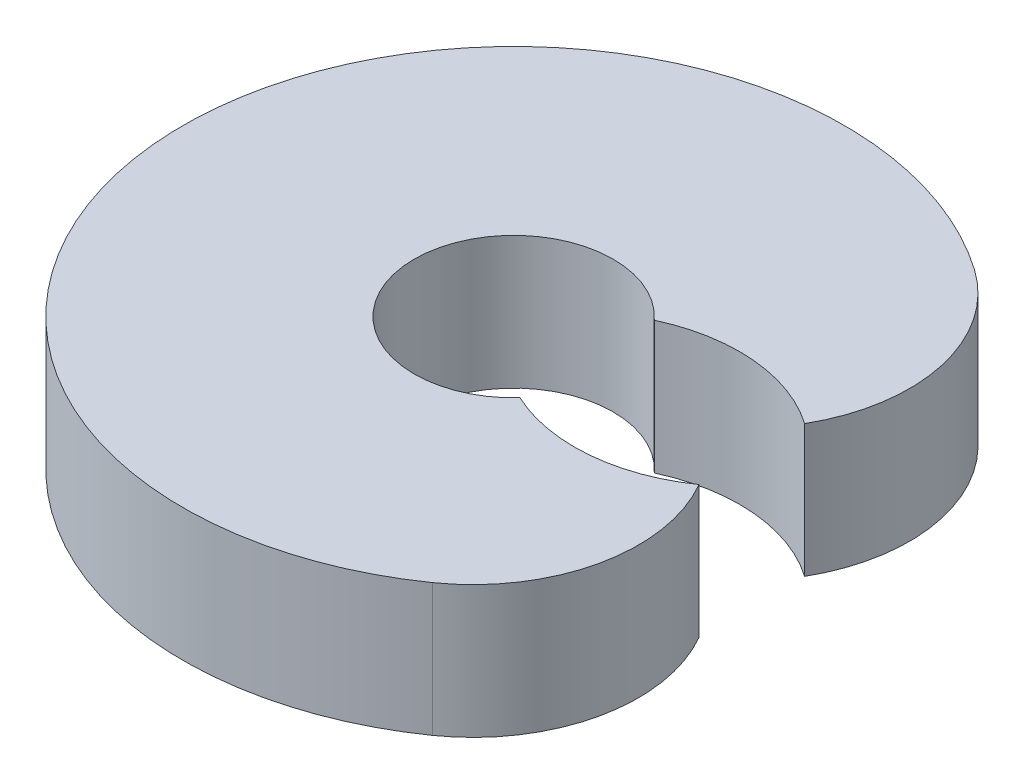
SolidWorks part; units mm, degrees
ref_plane "Front Plane" through (0, 0, 0) normal (0, 0, 1) x (1, 0, 0)
ref_plane "Top Plane" through (0, 0, 0) normal (0, 1, 0) x (1, 0, 0)
ref_plane "Right Plane" through (0, 0, 0) normal (1, 0, 0) x (0, 0, -1)
sketch "Sketch1" plane through (0, 0, 0) normal (0, 1, 0) x (1, 0, 0)
  line L0 (0, 0) -> (306.415, 437.6059) construction
  line L1 (0, 0) -> (309.4275, -441.9083) construction
  line L2 (0, 0) -> (-523.9824, 0) construction
  line L3 (143.3941, 204.788) -> (531.3216, -19.1821) construction
  line L4 (143.3941, -204.788) -> (502.0877, 2.3039) construction
  line L7 (0, 0) -> (-139.248, 298.6184) construction
  line L8 (-105.6546, 226.5769) -> (110.9872, 101.4988) construction
  arc A0 (286.7882, 409.576) -> (286.7882, -409.576) centre (0, 0) ccw
  arc A1 (110.9872, 101.4988) -> (110.9872, -101.4988) centre (0, 0) ccw
  circle A2 centre (0, 0) radius 250 construction
  arc A3 (359.9005, 79.788) -> (286.7882, 409.576) centre (143.3941, 204.788) ccw
  arc A4 (286.7882, -409.576) -> (359.9005, -79.788) centre (143.3941, -204.788) ccw
  arc A5 (110.9872, 101.4988) -> (359.9005, 79.788) centre (216.6276, -125.0848) cw
  arc A6 (110.9872, -101.4988) -> (359.9005, -79.788) centre (216.6276, 125.0848) ccw
  dimension "D1" = 1000
  dimension "D2" = 300.8
  dimension "D5" = 500
  dimension "D6" = 500
  dimension "D11" = 250
  dimension "D3" = 125
  dimension "D4" = 125
  dimension "D7" = 85
  dimension "D8" = 85
  dimension "D9" = 65
  dimension "D10" = 145
extrude "Boss-Extrude1" add sketch "Sketch1" along normal blind 200 from offset 5
